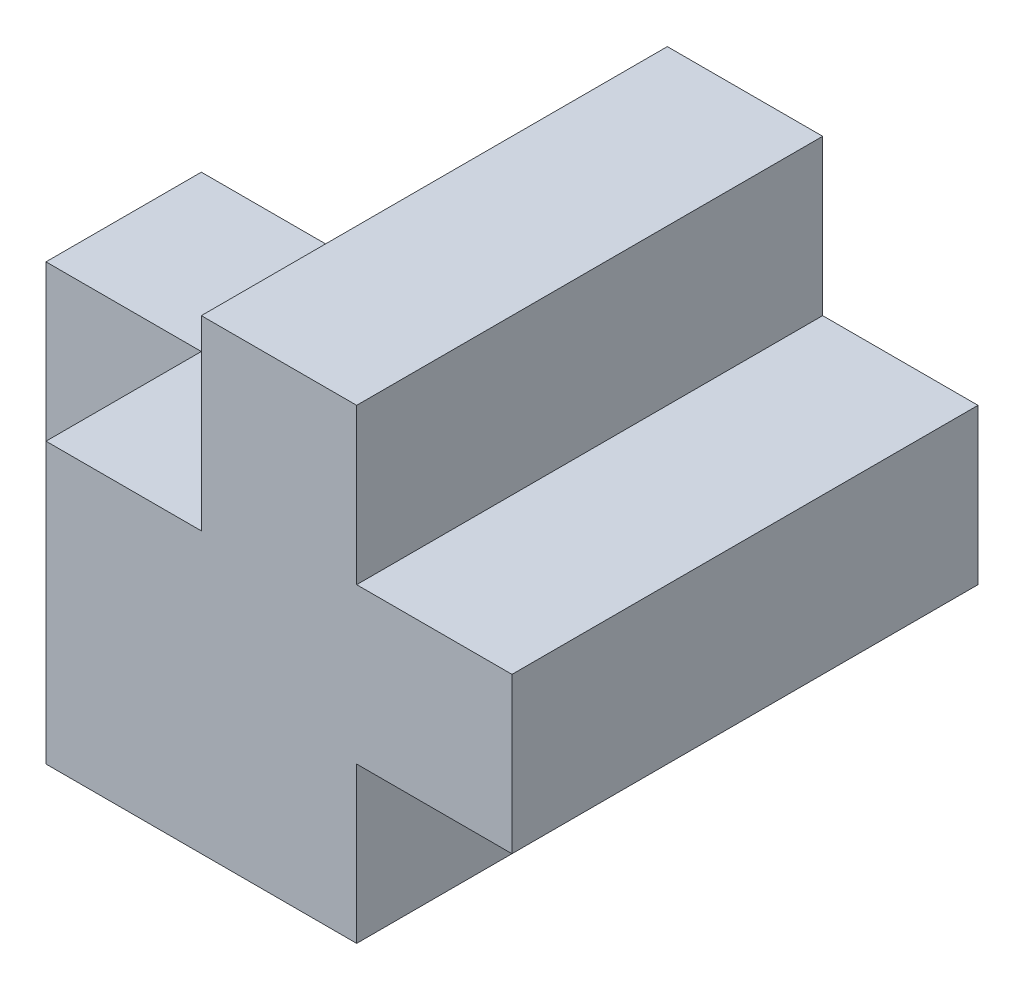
SolidWorks part; units mm, degrees
ref_plane "前视基准面" through (0, 0, 0) normal (0, 0, 1) x (1, 0, 0)
ref_plane "上视基准面" through (0, 0, 0) normal (0, 1, 0) x (1, 0, 0)
ref_plane "右视基准面" through (0, 0, 0) normal (1, 0, 0) x (0, 0, -1)
sketch "草图1" plane through (0, 0, 0) normal (0, 0, 1) x (1, 0, 0)
  line L0 (0, 0) -> (0, 75)
  line L1 (0, 75) -> (50, 75)
  line L2 (50, 75) -> (50, 25)
  line L3 (50, 25) -> (100, 25)
  line L4 (100, 25) -> (100, -25)
  line L5 (100, -25) -> (50, -25)
  line L6 (50, -25) -> (50, -75)
  line L7 (50, -75) -> (0, -75)
  line L8 (0, -75) -> (0, 0)
  dimension "D1" = 75
  dimension "D2" = 75
  dimension "D3" = 50
  dimension "D4" = 50
  dimension "D5" = 50
  dimension "D6" = 50
  dimension "D7" = 50
extrude "拉伸1" add sketch "草图1" against normal blind 90
sketch "草图2" plane through (0, -75, 0) normal (0, -1, 0) x (1, 0, 0)
  line L0 (0, -90) -> (-50, -90)
  line L1 (-50, -90) -> (-50, -40)
  line L2 (-50, -40) -> (-100, -40)
  line L3 (-100, -40) -> (-100, 10)
  line L4 (-100, 10) -> (-50, 10)
  line L5 (-50, 10) -> (-50, 60)
  line L6 (-50, 60) -> (0, 60)
  line L7 (0, 60) -> (0, -90)
  dimension "D1" = 50
  dimension "D2" = 50
  dimension "D3" = 50
  dimension "D4" = 50
  dimension "D5" = 50
  dimension "D6" = 50
extrude "拉伸2" add sketch "草图2" against normal blind 90
sketch "草图4" plane through (0, 0, 0) normal (0, 0, 1) x (1, 0, 0)
  line L0 (0, 75) -> (50, 75)
  line L1 (50, 75) -> (50, 25)
  line L2 (50, 25) -> (100, 25)
  line L3 (100, 25) -> (50, 25) construction
  line L4 (100, 25) -> (100, -25)
  line L5 (100, -25) -> (50, -25)
  line L6 (50, -25) -> (50, -75)
  line L7 (50, -75) -> (0, -75)
  line L8 (0, -75) -> (50, -75) construction
  line L9 (0, -75) -> (0, 75)
extrude "拉伸4" add sketch "草图4" along normal up to surface (60 mm away)
